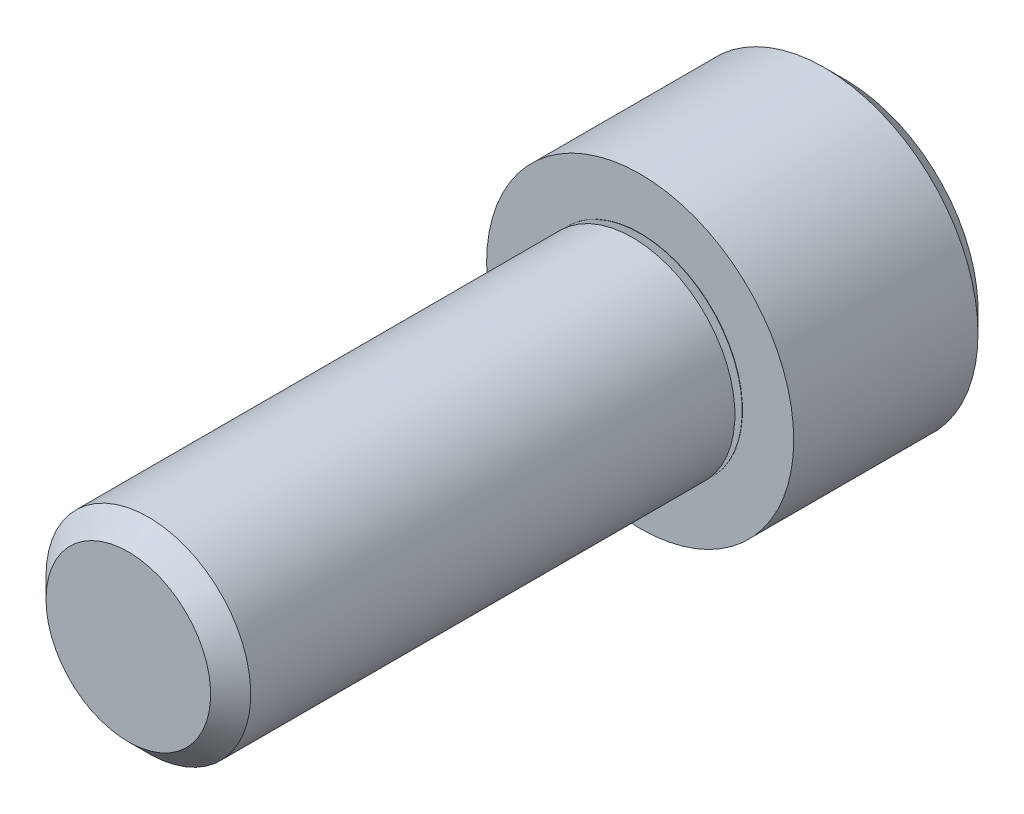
SolidWorks part; units mm, degrees
ref_plane "Front" through (0, 0, 0) normal (0, 0, 1) x (1, 0, 0)
ref_plane "Top" through (0, 0, 0) normal (0, 1, 0) x (1, 0, 0)
ref_plane "Right" through (0, 0, 0) normal (1, 0, 0) x (0, 0, -1)
sketch "Logo3_Revol_Axis" plane through (0, 0, 0) normal (0, 1, 0) x (1, 0, 0)
  line L0 (0, -43.5172) -> (0, 43.5172) construction
sketch "Logo3_bib1" plane through (0, 0, 0) normal (0, -1, 0) x (-1, 0, 0)
  line L0 (0, -15.875) -> (0, 6.35)
  line L1 (0, 6.35) -> (4.1275, 6.35)
  line L2 (4.7625, 5.715) -> (4.7625, 0)
  line L3 (4.7625, 0) -> (3.175, 0)
  line L4 (3.175, 0) -> (3.175, -0.01)
  line L5 (3.175, -15.2527) -> (2.5527, -15.875)
  line L6 (2.5527, -15.875) -> (0, -15.875)
  line L7 (3.175, -0.01) -> (2.6661, -0.01)
  line L8 (2.6593, -0.0488) -> (3.175, -0.2365)
  line L9 (3.175, -0.2365) -> (3.175, -15.2527)
  line L10 (0, 10.5852) -> (0, -63.2873) construction
  line L11 (4.1275, 6.35) -> (4.7625, 5.715)
  arc A1 (2.6661, -0.01) -> (2.6593, -0.0488) centre (2.6661, -0.03) ccw
  point P17 (2.5527, -0.01)
  point P19 (4.7625, 6.35)
revolve "Revolve1" add sketch "Logo3_bib1" angle 360 about L10
sketch "Logo3_bib2" plane through (0, 0, -6.35) normal (0, 0, -1) x (1, 0, 0)
  line L1 (2.7496, 0) -> (1.3748, 2.3813)
  line L2 (1.3748, 2.3813) -> (-1.3748, 2.3813)
  line L3 (-1.3748, 2.3813) -> (-2.7496, 0)
  line L4 (-2.7496, 0) -> (-1.3748, -2.3813)
  line L5 (-1.3748, -2.3813) -> (1.3748, -2.3813)
  line L6 (1.3748, -2.3813) -> (2.7496, 0)
  circle A0 centre (0, 0) radius 2.3812 construction
  dimension "Logo3_c1" = 4.7625
extrude "Cut-Extrude1" cut sketch "Logo3_bib2" against normal blind 3.175
equation "\"DIA2@Logo3_bib1\" = \"Logo3_d1-pas@Logo3_bib1\""
equation "\"LGT1@Logo3_bib1\" = \"Logo3_d1@Logo3_bib1\""
equation "\"D1@Cut-Extrude1\" = \"Logo3_d1@Logo3_bib1\"/2."
equation "\"D2@Cosmetic Thread1\" = \"Logo3_d1-pas@Logo3_bib1\""
equation "\"D5@Logo3_bib1\"=\"Logo3_d1@Logo3_bib1\"*.1"
